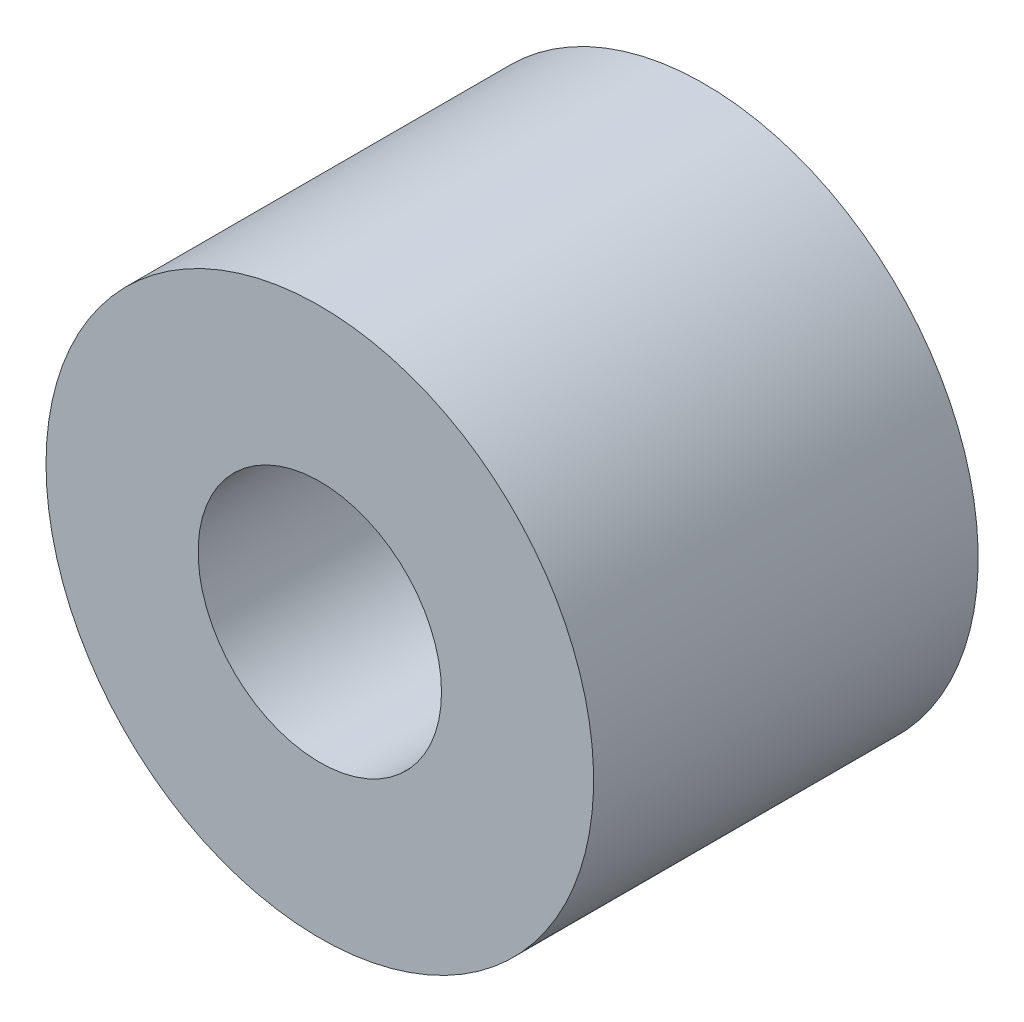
SolidWorks part; units mm, degrees
ref_plane "Front Plane" through (0, 0, 0) normal (0, 0, 1) x (1, 0, 0)
ref_plane "Top Plane" through (0, 0, 0) normal (0, 1, 0) x (1, 0, 0)
ref_plane "Right Plane" through (0, 0, 0) normal (1, 0, 0) x (0, 0, -1)
imported_body "Imported1"
sketch "Sketch2" plane through (0, 0, 0) normal (0, 0, 1) x (1, 0, 0)
  circle A0 centre (0, 0) radius 2.54
  circle A1 centre (0, 0) radius 5.153
  circle A2 centre (0, 0) radius 5.153
  dimension "D1" = 0
extrude "Boss-Extrude2" add sketch "Sketch2" against normal up to surface (8.0264 mm away)
sketch "Sketch3" plane through (0, 0, 0) normal (0, 0, 1) x (1, 0, 0)
  circle A0 centre (0, 0) radius 2.54
extrude "Cut-Extrude1" cut sketch "Sketch3" against normal blind 8.763
sketch "Sketch4" plane through (0, 0, -8.0264) normal (0, 0, -1) x (-1, 0, 0)
  circle A1 centre (0, 0) radius 5.715
  circle A2 centre (0, 0) radius 2.54
extrude "Boss-Extrude3" add sketch "Sketch4" against normal up to surface (8.0264 mm away)
